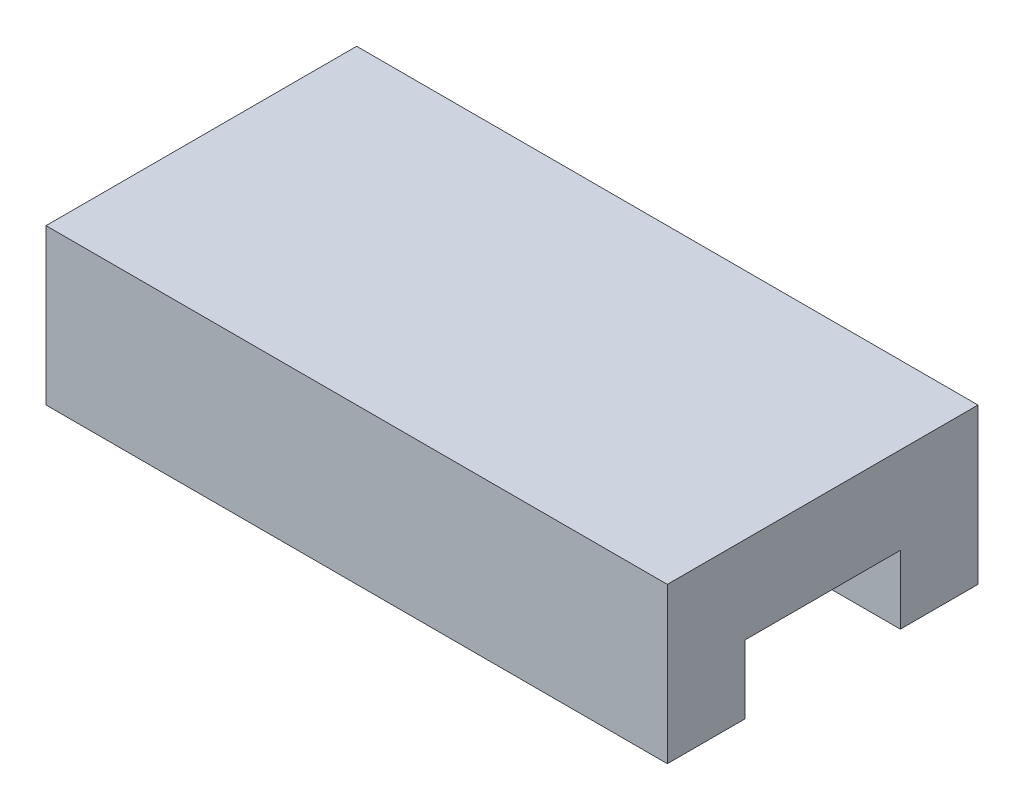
SolidWorks part; units mm, degrees
ref_plane "前视基准面" through (0, 0, 0) normal (0, 0, 1) x (1, 0, 0)
ref_plane "上视基准面" through (0, 0, 0) normal (0, 1, 0) x (1, 0, 0)
ref_plane "右视基准面" through (0, 0, 0) normal (1, 0, 0) x (0, 0, -1)
sketch "Sketch1" plane through (0, 0, 0) normal (0, 0, 1) x (1, 0, 0)
  line L0 (0, -31.7135) -> (0, 84.3017) construction
  line L1 (-100, 50) -> (100, 50)
  line L2 (-100, 50) -> (-100, 0)
  line L3 (-100, 0) -> (100, 0)
  line L4 (100, 50) -> (100, 0)
  dimension "D1" = 200
  dimension "D2" = 50
extrude "Extrude1" add sketch "Sketch1" against normal blind 100
sketch "Sketch2" plane through (-100, 0, 0) normal (-1, 0, 0) x (0, 0, 1)
  line L0 (-25, 0) -> (-25, 22)
  line L1 (-100, 0) -> (0, 0) construction
  line L2 (-25, 22) -> (-75, 22)
  line L3 (-75, 22) -> (-75, 0)
  line L4 (-75, 0) -> (-25, 0)
  line L5 (-50, -10.281) -> (-50, 38.7292) construction
  line L6 (-100, 50) -> (-100, 0) construction
  line L7 (0, 50) -> (0, 0) construction
  dimension "D1" = 22
  dimension "D2" = 50
extrude "Cut-Extrude1" cut sketch "Sketch2" against normal through all
